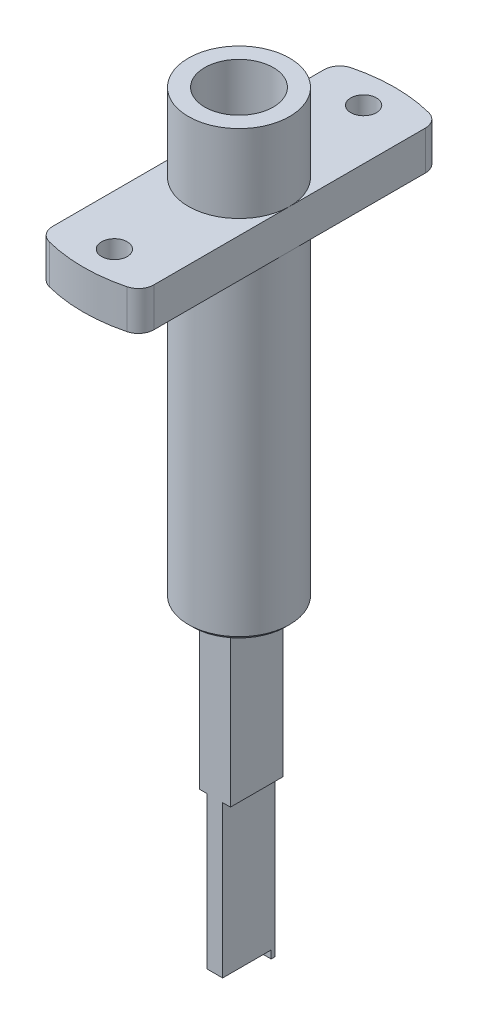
SolidWorks part; units mm, degrees
ref_plane "前视基准面" through (0, 0, 0) normal (0, 0, 1) x (1, 0, 0)
ref_plane "上视基准面" through (0, 0, 0) normal (0, 1, 0) x (1, 0, 0)
ref_plane "右视基准面" through (0, 0, 0) normal (1, 0, 0) x (0, 0, -1)
sketch "草图1" plane through (0, 0, 0) normal (0, 0, 1) x (1, 0, 0)
  line L0 (0, 78.7341) -> (0, 0) construction
  line L2 (0, 0) -> (-6.5, 0)
  line L3 (0, 0) -> (0, -95)
  line L4 (0, -95) -> (-6.5, -95)
  line L5 (-6.5, 0) -> (-6.5, -95)
  dimension "D1" = 95
  dimension "D2" = 13
revolve "旋转1" add sketch "草图1" angle 360 about L0
sketch "草图9" plane through (0, 0, 0) normal (0, 1, 0) x (1, 0, 0)
  circle A0 centre (0, 0) radius 12.5
  dimension "D1" = 25
extrude "切除-拉伸6" cut sketch "草图9" against normal blind 8
sketch "草图10" plane through (0, -8, 0) normal (0, 1, 0) x (1, 0, 0)
  circle A0 centre (0, 0) radius 4.4582
  circle A1 centre (0, 0) radius 20
  dimension "D1" = 40
extrude "凸台-拉伸1" add sketch "草图10" against normal blind 5
sketch "草图12" plane through (0, -8, 0) normal (0, 1, 0) x (1, 0, 0)
  line L0 (0, 14.8842) -> (0, -16.7242) construction
  circle A0 centre (0, 0) radius 16 construction
  point P5 (0, 16)
  point P6 (0, -16)
  dimension "D1" = 32
hole_wizard "M4 螺纹孔1" positions "草图13" profile "草图14" tap size "M4" standard "GB"
sketch "草图13" plane through (0, -8, 0) normal (0, 1, 0) x (1, 0, 0)
  point P0 (0, -16)
  point P3 (0, 16)
sketch "草图14" plane through (0, -8, 16) normal (1, 0, 0) x (0, 0, 1)
  line L0 (0, 0) -> (0, 12.4914)
  line L1 (0, 12.4914) -> (1.65, 11.5)
  line L2 (1.65, 11.5) -> (1.65, 0)
  line L5 (1.65, 0) -> (0, 0)
  line L10 (0, 12.4914) -> (-1.65, 11.5) construction
  line L11 (0, -6.35) -> (0, 107.95) construction
  dimension "螺纹孔钻头直径" = 3.3
  dimension "螺纹孔钻头深度" = 11.5
  dimension "导头角度" = 118
sketch "草图15" plane through (0, -8, 0) normal (0, 1, 0) x (1, 0, 0)
  line L0 (0, 22.8553) -> (0, -19.6721) construction
  line L1 (6.5, 20) -> (6.5, -20)
  line L2 (-26.5, 20) -> (-6.5, 20)
  line L3 (-26.5, 20) -> (-26.5, -20)
  line L4 (-26.5, -20) -> (-6.5, -20)
  line L5 (-6.5, 20) -> (-6.5, -20)
  line L6 (26.5, -20) -> (6.5, -20)
  line L7 (26.5, 20) -> (26.5, -20)
  line L8 (26.5, 20) -> (6.5, 20)
  line L9 (-41.1271, 0) -> (11.0145, 0) construction
  dimension "D1" = 13
  dimension "D2" = 20
  dimension "D3" = 40
extrude "切除-拉伸7" cut sketch "草图15" against normal blind 10
sketch "草图16" plane through (0, -8, 0) normal (0, 1, 0) x (1, 0, 0)
  circle A0 centre (0, 0) radius 6.5
  dimension "D1" = 13
extrude "凸台-拉伸2" add sketch "草图16" along normal blind 10
sketch "草图17" plane through (0, -95, 0) normal (0, -1, 0) x (1, 0, 0)
  circle A0 centre (0, 0) radius 5.5
  circle A1 centre (0, 0) radius 6.5 construction
  circle A2 centre (0, 0) radius 6.5
  dimension "D1" = 11
extrude "切除-拉伸8" cut sketch "草图17" against normal blind 40
hole_wizard "G1/8 螺纹孔1" positions "草图19" profile "草图20" tap size "G1/8" standard "GB"
sketch "草图19" plane through (0, 2, 0) normal (0, 1, 0) x (1, 0, 0)
  point P0 (0, 0)
sketch "草图20" plane through (0, 2, 0) normal (1, 0, 0) x (0, 0, 1)
  line L0 (0, 0) -> (0, 47.6438)
  line L1 (0, 47.6438) -> (4.4, 45)
  line L2 (4.4, 45) -> (4.4, 0)
  line L5 (4.4, 0) -> (0, 0)
  line L10 (0, 47.6438) -> (-4.4, 45) construction
  line L11 (0, -6.35) -> (0, 107.95) construction
  dimension "螺纹孔钻头直径" = 8.8
  dimension "螺纹孔钻头深度" = 45
  dimension "导头角度" = 118
sketch "草图21" plane through (0, 2, 0) normal (0, 1, 0) x (1, 0, 0)
  circle A0 centre (0, 0) radius 4.4
extrude "切除-拉伸12" cut sketch "草图21" against normal blind 55
sketch "草图24" plane through (0, -95, 0) normal (0, -1, 0) x (1, 0, 0)
  line L0 (-2, 5.1235) -> (-2, -5.1235)
  line L1 (0, 8.9797) -> (0, -3.5) construction
  line L2 (2, 5.1235) -> (2, -5.1235)
  circle A0 centre (0, 0) radius 5.5 construction
  arc A1 (-2, 5.1235) -> (-2, -5.1235) centre (0, 0) ccw
  arc A6 (2, -5.1235) -> (2, 5.1235) centre (0, 0) ccw
  dimension "D1" = 4
extrude "切除-拉伸15" cut sketch "草图24" against normal up to surface (40 mm away)
sketch "草图25" plane through (0, -95, 0) normal (0, -1, 0) x (1, 0, 0)
  line L0 (0, -1.5) -> (0, 1.5) construction
  line L1 (-0.5, -1.5) -> (-0.5, 1.5)
  line L2 (0.5, -1.5) -> (0.5, 1.5)
  arc A0 (-0.5, -1.5) -> (0.5, -1.5) centre (0, -1.5) ccw
  arc A1 (0.5, 1.5) -> (-0.5, 1.5) centre (0, 1.5) ccw
  point P2 (0, 0)
  dimension "D1" = 0.5
  dimension "D2" = 3
extrude "切除-拉伸16" cut sketch "草图25" against normal up to next
fillet "圆角1" radius 2 4 edges at (-6.5, -10.5, -18.9143) (-6.5, -10.5, 18.9143) (6.5, -10.5, 18.9143) (6.5, -10.5, -18.9143)
sketch "草图27" plane through (0, -95, 0) normal (0, -1, 0) x (1, 0, 0)
  line L0 (-2, 0) -> (17.203, 0) construction
  line L1 (-2, -5.1235) -> (-2, 5.1235) construction
  line L2 (-2, 4.1) -> (2, 4.1)
  line L3 (-2, 2.6) -> (-2, -2.6)
  line L4 (-2, -4.1) -> (2, -4.1)
  line L5 (-0.5, 2.6) -> (-2, 2.6)
  line L6 (2, 5.1235) -> (2, -5.1235) construction
  line L7 (2, 4.1) -> (2, 5.1235)
  line L8 (-0.5, -2.6) -> (-2, -2.6)
  line L9 (-2, 5.1235) -> (-2, -5.1235)
  line L10 (2, -5.1235) -> (2, 5.1235)
  line L11 (-2, 5.1235) -> (-2, 4.1)
  line L12 (2, -5.1235) -> (2, -4.1)
  line L13 (-0.5, 1.5) -> (-0.5, -1.5) construction
  line L14 (-0.5, 2.6) -> (-0.5, -2.6)
  line L15 (-2, -5.1235) -> (-2, -4.1)
  arc A2 (-2, -5.1235) -> (2, -5.1235) centre (0, 0) ccw
  arc A3 (2, 5.1235) -> (-2, 5.1235) centre (0, 0) ccw
  arc A4 (-2, -5.1235) -> (2, -5.1235) centre (0, 0) ccw
  arc A5 (2, 5.1235) -> (-2, 5.1235) centre (0, 0) ccw
  dimension "D1" = 8.2
  dimension "D4" = 1.5
  dimension "D2" = 0
extrude "凸台-拉伸3" add sketch "草图27" along normal blind 0.5
chamfer "倒角1" distance 0.5 angle 45 1 edges at (0, -55, -6.5)
sketch "草图28" plane through (0, -95.5, 0) normal (0, -1, 0) x (1, 0, 0)
  line L0 (-11.4076, 0) -> (12.4754, 0) construction
  line L1 (-2, 4.1) -> (2, 4.1)
  line L2 (-2, 4.1) -> (-2, 4.6)
  line L3 (-2, 4.6) -> (2, 4.6)
  line L4 (2, 4.1) -> (2, 4.6)
  line L5 (2, 4.1) -> (2, -4.1) construction
  line L6 (-1.5003, 4.6) -> (1.5003, 4.6) construction
  line L7 (-2, 4.1) -> (-2, 4.5826) construction
  line L8 (2, 4.1) -> (2, 4.5826) construction
  line L9 (-1.5003, 4.6) -> (-1.5003, 4.6) construction
  line L10 (1.5003, 4.6) -> (1.5003, 4.6) construction
  line L11 (2, -4.1) -> (2, -4.6)
  line L12 (-2, -4.6) -> (2, -4.6)
  line L13 (-2, -4.1) -> (-2, -4.6)
  line L14 (-2, -4.1) -> (2, -4.1)
  dimension "D1" = 0.5
extrude "凸台-拉伸4" add sketch "草图28" against normal up to surface (40.5 mm away)
sketch "草图29" plane through (0, -95.5, 0) normal (0, -1, 0) x (1, 0, 0)
  line L0 (2, 4.6) -> (-2, 4.6)
  line L1 (-2, 4.1) -> (2, 4.1) construction
  line L2 (2, -5.1235) -> (-2, -5.1235)
  line L3 (-2, 5.1235) -> (-2, 4.1)
  line L4 (-2, 4.1) -> (2, 4.1)
  line L5 (2, 4.1) -> (2, 5.1235)
  line L6 (-2, 5.1235) -> (-2, 4.6)
  line L8 (2, 4.6) -> (2, 5.1235)
  line L9 (2, -5.1235) -> (2, -4.1)
  line L10 (2, -4.1) -> (-2, -4.1)
  line L11 (-2, -4.1) -> (-2, -5.1235)
  arc A1 (2, 5.1235) -> (-2, 5.1235) centre (0, 0) ccw
  arc A2 (2, 5.1235) -> (-2, 5.1235) centre (0, 0) ccw
  arc A3 (-2, -5.1235) -> (2, -5.1235) centre (0, 0) ccw
  arc A4 (-2, -5.1235) -> (2, -5.1235) centre (0, 0) ccw
  dimension "D2" = 0
  dimension "D3" = 0.5
  dimension "D1" = 0
extrude "切除-拉伸17" cut sketch "草图29" against normal up to surface (40.5 mm away)
sketch "草图30" plane through (0, -95.5, 0) normal (0, -1, 0) x (1, 0, 0)
  line L4 (-2, -5.1235) -> (2, -5.1235)
  line L5 (2, -5.1235) -> (2, -4.1)
  line L6 (2, -4.1) -> (-2, -4.1)
  line L7 (-2, -4.1) -> (-2, -5.1235)
  line L8 (-2, -5.1235) -> (2, -5.1235)
  line L9 (2, -5.1235) -> (2, -4.1)
  line L10 (2, -4.1) -> (-2, -4.1)
  line L11 (-2, -4.1) -> (-2, -5.1235)
  dimension "D1" = 0
extrude "切除-拉伸18" cut sketch "草图30" against normal up to surface (0.5 mm away)
sketch "草图31" plane through (0, -95.5, 0) normal (0, -1, 0) x (1, 0, 0)
  line L0 (2, 4.6) -> (-2, 4.6) construction
  line L1 (-2, -5.1235) -> (-1, -5.1235)
  line L2 (-2, -5.1235) -> (-2, 4.6)
  line L3 (-2, 4.6) -> (-1, 4.6)
  line L4 (-1, -5.1235) -> (-1, 4.6)
  line L5 (-0.5, -2.6) -> (-0.5, 2.6) construction
  line L6 (-2, -5.1235) -> (2, -5.1235) construction
  line L7 (2, 4.6) -> (1, 4.6)
  line L8 (2, 4.6) -> (2, -5.1235)
  line L9 (2, -5.1235) -> (1, -5.1235)
  line L10 (1, 4.6) -> (1, -5.1235)
  line L11 (0.5, -1.5) -> (0.5, 1.5) construction
  dimension "D1" = 0.5
  dimension "D2" = 0.5
extrude "切除-拉伸19" cut sketch "草图31" against normal blind 20
sketch "草图32" plane through (0, -95, 0) normal (0, -1, 0) x (1, 0, 0)
  line L0 (-1, -5.1235) -> (-1, -2.6) construction
  line L1 (1, -5.1235) -> (-1, -5.1235)
  line L2 (1, -5.1235) -> (1, -3.1235)
  line L3 (1, -3.1235) -> (-1, -3.1235)
  line L4 (-1, -5.1235) -> (-1, -3.1235)
  dimension "D1" = 2
extrude "凸台-拉伸5" add sketch "草图32" along normal blind 1
sketch "草图33" plane through (0, -95.5, 0) normal (0, -1, 0) x (1, 0, 0)
  line L4 (1, 4.1) -> (1, 4.6)
  line L5 (1, 4.6) -> (-1, 4.6)
  line L6 (-1, 4.6) -> (-1, 4.1)
  line L7 (-1, 4.1) -> (1, 4.1)
  line L8 (1, 4.1) -> (1, 4.6)
  line L9 (1, 4.6) -> (-1, 4.6)
  line L10 (-1, 4.6) -> (-1, 4.1)
  line L11 (-1, 4.1) -> (1, 4.1)
  dimension "D1" = 0
extrude "切除-拉伸20" cut sketch "草图33" against normal up to surface (0.5 mm away)
sketch "草图34" plane through (0, -95.5, 0) normal (0, -1, 0) x (1, 0, 0)
  line L4 (-0.5, 2.6) -> (-1, 2.6)
  line L5 (-1, 2.6) -> (-1, -2.6)
  line L6 (-1, -2.6) -> (-0.5, -2.6)
  line L7 (-0.5, -2.6) -> (-0.5, 2.6)
  line L8 (-0.5, 2.6) -> (-1, 2.6)
  line L9 (-1, 2.6) -> (-1, -2.6)
  line L10 (-1, -2.6) -> (-0.5, -2.6)
  line L11 (-0.5, -2.6) -> (-0.5, 2.6)
  dimension "D1" = 0
extrude "凸台-拉伸6" add sketch "草图34" along normal blind 0.5
sketch "草图35" plane through (0, -96, 0) normal (0, -1, 0) x (1, 0, 0)
  line L1 (-2, 4.6) -> (-2, -5.1235) construction
  line L2 (2, -5.1235) -> (-2, -5.1235)
  line L3 (2, -5.1235) -> (2, -3.6235)
  line L4 (2, -3.6235) -> (-2, -3.6235)
  line L5 (-2, -5.1235) -> (-2, -3.6235)
  line L7 (2, 4.6) -> (-2, 4.6)
  line L8 (2, 4.6) -> (2, 3.1)
  line L9 (2, 3.1) -> (-2, 3.1)
  line L10 (-2, 4.6) -> (-2, 3.1)
  dimension "D1" = 1.5
  dimension "D2" = 1.5
extrude "切除-拉伸21" cut sketch "草图35" against normal up to surface (41 mm away)
sketch "草图36" plane through (0, -96, 0) normal (0, -1, 0) x (1, 0, 0)
  line L0 (-1, 2.6) -> (-1, -2.6) construction
  line L1 (-0.5, 2.6) -> (-1, 2.6)
  line L2 (-0.5, 2.6) -> (-0.5, 2.1)
  line L3 (-0.5, 2.1) -> (-1, 2.1)
  line L4 (-1, 2.6) -> (-1, 2.1)
  line L5 (-1, -3.6235) -> (-1, 3.1) construction
  line L6 (-0.5, -2.6) -> (-1, -2.6)
  line L7 (-0.5, -2.6) -> (-0.5, -2.1235)
  line L8 (-0.5, -2.1235) -> (-1, -2.1235)
  line L9 (-1, -2.6) -> (-1, -2.1235)
  line L10 (1, -3.1235) -> (-1, -3.1235) construction
  line L11 (-1, 3.1) -> (1, 3.1) construction
  dimension "D1" = 1
  dimension "D2" = 1
extrude "切除-拉伸22" cut sketch "草图36" against normal up to surface (1 mm away)
